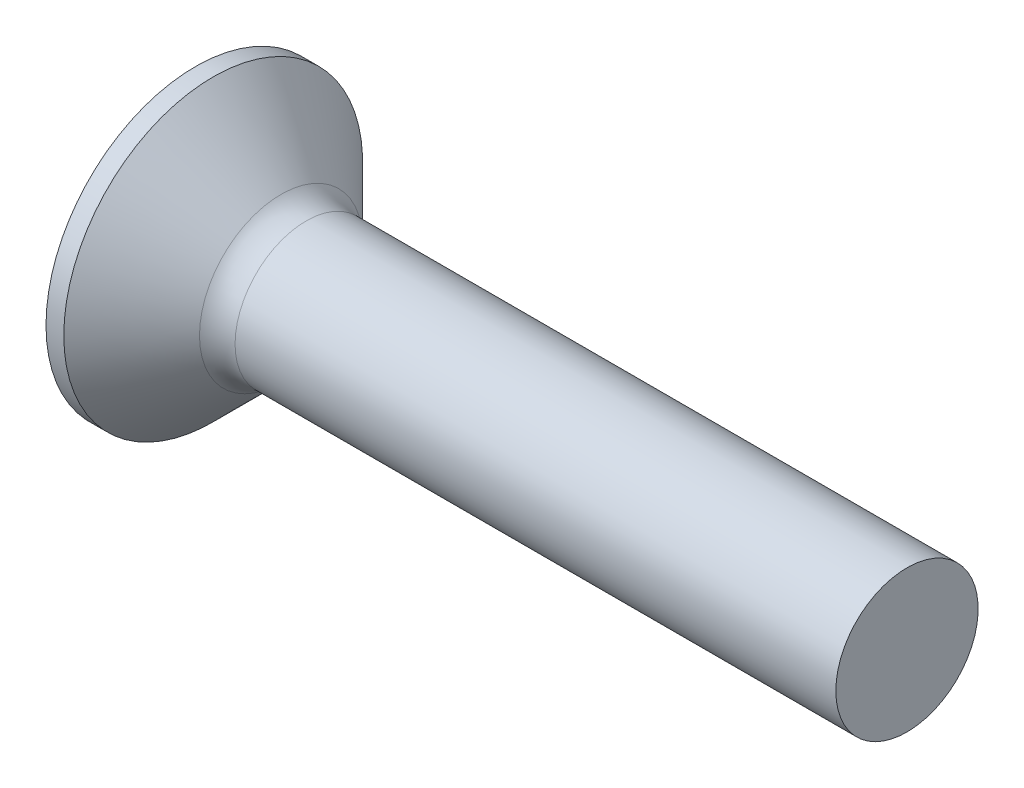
SolidWorks part; units mm, degrees
ref_plane "Plane1" through (0, 0, 0) normal (0, 0, 1) x (1, 0, 0)
ref_plane "Plane2" through (0, 0, 0) normal (0, 1, 0) x (1, 0, 0)
ref_plane "Plane3" through (0, 0, 0) normal (1, 0, 0) x (0, 0, -1)
revolve "Base-Revolve" add sketch "BodySke"
sketch "BodySke" plane through (0, 0, 0) normal (0, 0, 1) x (1, 0, 0)
  line L0 (0, 0) -> (0, 4.2)
  line L1 (0, 4.2) -> (0.5, 4.2)
  line L2 (2.7, 2) -> (20, 2)
  line L3 (20, 2) -> (20, 0)
  line L4 (20, 0) -> (0, 0)
  line L5 (-6.35, 0) -> (82.55, 0) construction
  line L6 (2.7, -2) -> (20, -2) construction
  line L7 (0.5, -4.2) -> (2.7, -2) construction
  line L8 (0.5, 4.2) -> (2.7, 2)
  line L9 (0, -4.2) -> (0.5, -4.2) construction
  line L10 (3.4, 3.5875) -> (3.4, -5.9375) construction
  line L11 (0, 6.35) -> (0, -3.175) construction
  dimension "Diameter" = 4
  dimension "Length" = 20
  dimension "Head_ht" = 2.7
  dimension "Head_dia" = 8.4
  dimension "Head_ang" = 90
  dimension "D6" = 0.5
  dimension "Advance" = 0.7
  dimension "Thread_nom" = 20
fillet "Fillet1" radius 1 1 edges at (2.7, 0, 2)
sketch "Sketch3" plane through (0, 0, 0) normal (-1, 0, 0) x (0, 0, 1)
  line L0 (-0.515, 2.2) -> (0.515, 2.2)
  line L1 (0.515, 2.2) -> (0.515, -2.2)
  line L2 (0.515, -2.2) -> (-0.515, -2.2)
  line L3 (-0.515, -2.2) -> (-0.515, 2.2)
  dimension "D1" = 2.2
  dimension "Cross_dia" = 4.4
  dimension "D2" = 0.515
  dimension "Cross_width" = 1.03
ref_plane "Plane4" through (2.51, 0, 0) normal (-1, 0, 0) x (0, 0, 1)
sketch "Sketch4" plane through (2.51, 0, 0) normal (-1, 0, 0) x (0, 0, 1)
  line L0 (-0.515, 0.9486) -> (0.515, 0.9486)
  line L3 (0.515, 0.9486) -> (0.515, -0.9486)
  line L4 (0.515, -0.9486) -> (-0.515, -0.9486)
  line L5 (-0.515, -0.9486) -> (-0.515, 0.9486)
  dimension "D1" = 1.03
  dimension "D2" = 1.8971
  dimension "D3" = 0.515
  dimension "D4" = 0.9486
loft "Recess" cut profiles "Sketch3", "Sketch4"
pattern_circular "RecPat" count 2 every 90 about axis through (0, 0, 0) along (1, 0, 0) of "Recess"
sketch "RecCorSke" plane through (0, 0, 0) normal (0, 0, 1) x (1, 0, 0)
  line L0 (-3.175, 0) -> (15.875, 0) construction
  line L2 (0, 0) -> (0, 1.0265)
  line L3 (0, 1.0265) -> (2.51, 0.851)
  line L4 (2.51, 0.851) -> (2.7865, 0)
  line L5 (2.7865, 0) -> (0, 0)
  dimension "Diameter" = 1.702
  dimension "Depth" = 2.51
  dimension "Draft_angle" = 4
  dimension "Bottom_angle" = 18
revolve "RecessCore" cut sketch "RecCorSke" angle 360 about L0
sketch "ThdSchSke" plane through (0, 0, 0) normal (0, 0, 1) x (1, 0, 0)
  line L0 (3.4, -1.61) -> (3.1269, -2)
  line L1 (3.4, -1.61) -> (3.6731, -2)
  line L2 (3.6731, -2) -> (3.6731, -2.5)
  line L3 (-3.175, 0) -> (5.1513, 0) construction
  line L5 (3.6731, -2.5) -> (3.1269, -2.5)
  line L6 (3.1269, -2.5) -> (3.1269, -2)
  line L7 (0, 4.2) -> (0, -4.2) construction
  dimension "Thread_minor" = 3.22
  dimension "Diameter" = 4
  dimension "Start" = 3.4
  dimension "SideAngle" = 55
  dimension "VeeAngle" = 70
  dimension "Overcut" = 5
revolve "ThreadSchematic" [suppressed] cut sketch "ThdSchSke" angle 360 about L3
pattern_linear "ThdSchPat" [suppressed]
equation "\"D1@Sketch3\" = \"Cross_dia@Sketch3\" / 2"
equation "\"D2@Sketch3\" = \"Cross_width@Sketch3\" / 2"
equation "\"Depth@RecCorSke\" = \"Cross_depth@Plane4\""
equation "\"D1@Sketch4\" = \"Cross_width@Sketch3\""
equation "\"D2@Sketch4\" = \"Cross_dia@Sketch3\" - 2.0 * \"Cross_depth@Plane4\" * tan(26.5  * 0.017453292)"
equation "\"D3@Sketch4\" = \"D1@Sketch4\" / 2"
equation "\"D4@Sketch4\" = \"D2@Sketch4\" / 2"
equation "\"Thread_length@ThreadCosmetic\" = ((sgn( (\"Length@BodySke\" - \"Advance@BodySke\" * 1.0 - \"Head_ht@BodySke\" ) - \"Thread_nom@BodySke\" )-1)*( (\"Length@BodySke\" - \"Advance@BodySke\" * 1.0 - \"Head_ht@BodySke\" "
equation "\"Thread_minor@ThdSchSke\" = \"Thread_minor@ThreadCosmetic\""
equation "\"Diameter@ThdSchSke\" = \"Diameter@BodySke\""
equation "\"Overcut@ThdSchSke\" = \"Diameter@BodySke\" * 1.25"
equation "\"Start@ThdSchSke\" = 0.000001 + \"Length@BodySke\" - \"Thread_length@ThreadCosmetic\"  '---Countersunk---"
equation "\"Num_threads@ThdSchPat\" = int( \"Thread_length@ThreadCosmetic\" / \"Advance@BodySke\" + 0.999 )  + 1"
equation "\"Advance@ThdSchPat\" = \"Thread_length@ThreadCosmetic\" /  (\"Num_threads@ThdSchPat\" - 1) 'relax it"
